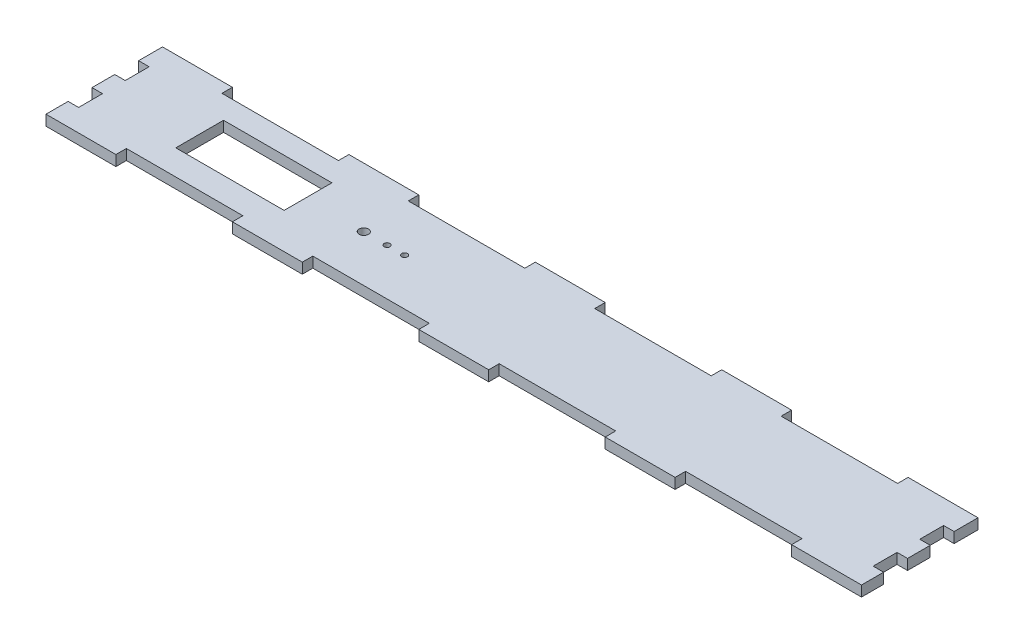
SolidWorks part; units mm, degrees
ref_plane "Front Plane" through (0, 0, 0) normal (0, 0, 1) x (1, 0, 0)
ref_plane "Top Plane" through (0, 0, 0) normal (0, 1, 0) x (1, 0, 0)
ref_plane "Right Plane" through (0, 0, 0) normal (1, 0, 0) x (0, 0, -1)
sketch "Sketch1" plane through (0, 0, 0) normal (0, 1, 0) x (1, 0, 0)
  line L1 (-350, 50) -> (350, 50)
  line L2 (-350, 50) -> (-350, 29.5)
  line L3 (-350, -50) -> (350, -50)
  line L4 (350, 50) -> (350, 29.5)
  line L5 (-350, 50) -> (350, -50) construction
  line L6 (-350, -50) -> (350, 50) construction
  line L7 (-350, 29.5) -> (-341, 29.5)
  line L9 (-350, 9) -> (-341, 9)
  line L10 (-341, 29.5) -> (-341, 9)
  line L11 (-350, -10.5) -> (-341, -10.5)
  line L12 (-341, -10.5) -> (-341, -31)
  line L13 (-350, -31) -> (-341, -31)
  line L14 (0, 131.3384) -> (0, -134.3722) construction
  line L15 (350, 9) -> (341, 9)
  line L16 (341, 29.5) -> (341, 9)
  line L17 (350, 29.5) -> (341, 29.5)
  line L19 (350, -10.5) -> (341, -10.5)
  line L20 (341, -10.5) -> (341, -31)
  line L21 (350, -31) -> (341, -31)
  line L23 (350, 9) -> (350, -10.5)
  line L24 (350, -31) -> (350, -50)
  line L26 (-350, -31) -> (-350, -50)
  line L27 (-350, 9) -> (-350, -10.5)
  point P0 (0, 0)
  dimension "D1" = 100
  dimension "D2" = 700
  dimension "D3" = 20.5
  dimension "D4" = 20.5
  dimension "D6" = 9
  dimension "D5" = 2
extrude "Boss-Extrude1" add sketch "Sketch1" along normal blind 9
sketch "Sketch2" plane through (0, 9, 0) normal (0, 1, 0) x (1, 0, 0)
  line L0 (350, 50) -> (-350, 50) construction
  line L1 (-290, 50) -> (-190, 50)
  line L2 (-290, 50) -> (-290, 41)
  line L3 (-290, 41) -> (-190, 41)
  line L4 (-190, 50) -> (-190, 41)
  line L25 (-359.8206, 0) -> (369.5266, 0) construction
  line L50 (-130, 50) -> (-130, 41)
  line L51 (-130, 50) -> (-30, 50)
  line L52 (-30, 50) -> (-30, 41)
  line L53 (-130, 41) -> (-30, 41)
  line L54 (30, 50) -> (30, 41)
  line L55 (30, 50) -> (130, 50)
  line L56 (130, 50) -> (130, 41)
  line L57 (30, 41) -> (130, 41)
  line L58 (190, 50) -> (190, 41)
  line L59 (190, 50) -> (290, 50)
  line L60 (290, 50) -> (290, 41)
  line L61 (190, 41) -> (290, 41)
  line L62 (350, 29.5) -> (350, 50) construction
  line L63 (190, -50) -> (290, -50)
  line L64 (290, -50) -> (290, -41)
  line L65 (190, -41) -> (290, -41)
  line L66 (190, -50) -> (190, -41)
  line L67 (30, -50) -> (130, -50)
  line L68 (130, -50) -> (130, -41)
  line L69 (30, -41) -> (130, -41)
  line L70 (30, -50) -> (30, -41)
  line L71 (-130, -50) -> (-30, -50)
  line L72 (-30, -50) -> (-30, -41)
  line L73 (-130, -41) -> (-30, -41)
  line L74 (-130, -50) -> (-130, -41)
  line L75 (-290, -41) -> (-190, -41)
  line L76 (-190, -50) -> (-190, -41)
  line L77 (-290, -50) -> (-190, -50)
  line L78 (-290, -50) -> (-290, -41)
  dimension "D1" = 60
  dimension "D2" = 100
  dimension "D4" = 9
  dimension "D3" = 60
  dimension "D5" = 4
extrude "Cut-Extrude1" cut sketch "Sketch2" against normal blind 9
sketch "Sketch3" plane through (0, 9, 0) normal (0, 1, 0) x (1, 0, 0)
  line L1 (-269.2659, 21.6602) -> (-176.2659, 21.6602)
  line L2 (-269.2659, 21.6602) -> (-269.2659, -19.3398)
  line L3 (-269.2659, -19.3398) -> (-176.2659, -19.3398)
  line L4 (-176.2659, 21.6602) -> (-176.2659, -19.3398)
  line L5 (-269.2659, 21.6602) -> (-176.2659, -19.3398) construction
  line L6 (-269.2659, -19.3398) -> (-176.2659, 21.6602) construction
  point P0 (-222.7659, 1.1602)
  dimension "D1" = 41
  dimension "D2" = 93
extrude "Cut-Extrude3" cut sketch "Sketch3" against normal through all
sketch "Sketch4" plane through (0, 9, 0) normal (0, 1, 0) x (1, 0, 0)
  line L0 (-106.2659, -0.9575) -> (-76.2659, -0.9575) construction
  line L1 (-176.2659, -19.3398) -> (-176.2659, 21.6602) construction
  circle A0 centre (-106.2659, -0.9575) radius 2.5
  circle A1 centre (-91.2659, -0.9575) radius 2.5
  circle A2 centre (-126.2659, -0.9575) radius 4
  dimension "D1" = 15
  dimension "D2" = 5
  dimension "D3" = 8
  dimension "D4" = 50
  dimension "D5" = 20
extrude "Cut-Extrude4" cut sketch "Sketch4" against normal through all
